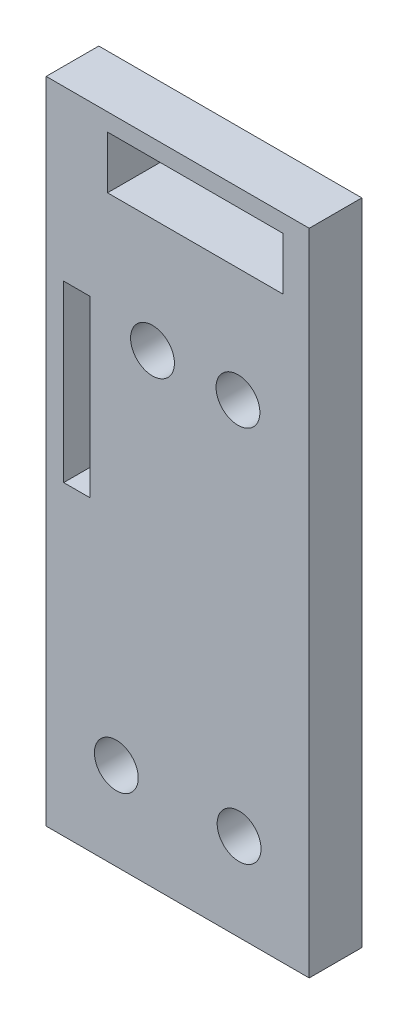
SolidWorks part; units mm, degrees
ref_plane "Front Plane" through (0, 0, 0) normal (0, 0, 1) x (1, 0, 0)
ref_plane "Top Plane" through (0, 0, 0) normal (0, 1, 0) x (1, 0, 0)
ref_plane "Right Plane" through (0, 0, 0) normal (1, 0, 0) x (0, 0, -1)
sketch "Sketch1" plane through (0, 0, 0) normal (0, 0, 1) x (1, 0, 0)
  line L0 (298.0287, 66.7515) -> (328.0287, 66.7515)
  line L1 (328.0287, 66.7515) -> (328.0287, -7.3014)
  line L2 (328.0287, -7.3014) -> (298.0287, -7.3014)
  line L3 (298.0287, -7.3014) -> (298.0287, 66.7515)
  line L4 (313.0287, -7.3014) -> (313.0287, 66.7515) construction
  line L5 (328.0287, 2.6986) -> (320.0287, 2.6986) construction
  line L6 (328.0287, 45.727) -> (325.0287, 45.727) construction
  line L7 (325.0287, 45.727) -> (325.0287, 55.727) construction
  line L8 (325.0287, 45.727) -> (325.0287, 35.727) construction
  line L9 (325.0287, 35.727) -> (305.0287, 35.727) construction
  line L10 (305.0287, 35.727) -> (305.0287, 55.727) construction
  line L11 (305.0287, 55.727) -> (325.0287, 55.727) construction
  line L12 (-196.7783, 47.5295) -> (305.0287, 47.5295) construction
  line L13 (303.0287, 27.6308) -> (303.0287, 47.5295) construction
  line L14 (305.0287, 27.6308) -> (305.0287, 35.727) construction
  line L15 (305.0287, 27.6308) -> (303.0287, 27.6308) construction
  line L16 (303.0287, 47.5295) -> (300.0287, 47.5295) construction
  line L17 (300.0287, 47.5295) -> (300.0287, 27.6308) construction
  line L18 (300.0287, 27.6308) -> (303.0287, 27.6308) construction
  line L19 (300.0287, 27.6308) -> (303.0287, 27.6308)
  line L20 (303.0287, 27.6308) -> (303.0287, 47.5295)
  line L21 (303.0287, 47.5295) -> (300.0287, 47.5295)
  line L22 (300.0287, 47.5295) -> (300.0287, 27.6308)
  line L23 (315.0287, 55.727) -> (315.0287, 35.727) construction
  line L24 (305.0287, 45.727) -> (310.1537, 45.727) construction
  line L25 (313.0287, 66.7515) -> (313.0287, 64.7515) construction
  line L26 (313.0287, 64.7515) -> (325.0287, 64.7515) construction
  line L27 (325.0287, 64.7515) -> (325.0287, 58.7515) construction
  line L28 (325.0287, 58.7515) -> (305.0287, 58.7515) construction
  line L29 (305.0287, 58.7515) -> (305.0287, 64.7515) construction
  line L30 (305.0287, 64.7515) -> (313.0287, 64.7515) construction
  line L31 (305.0287, 64.7515) -> (305.0287, 58.7515)
  line L32 (305.0287, 58.7515) -> (325.0287, 58.7515)
  line L33 (325.0287, 58.7515) -> (325.0287, 64.7515)
  line L34 (325.0287, 64.7515) -> (305.0287, 64.7515)
  circle A0 centre (320.0287, 2.6986) radius 2.5
  circle A1 centre (306.0287, 2.6986) radius 2.5
  circle A2 centre (310.1537, 45.727) radius 2.5
  circle A3 centre (319.9037, 45.727) radius 2.5
extrude "Boss-Extrude1" add sketch "Sketch1" along normal blind 6
